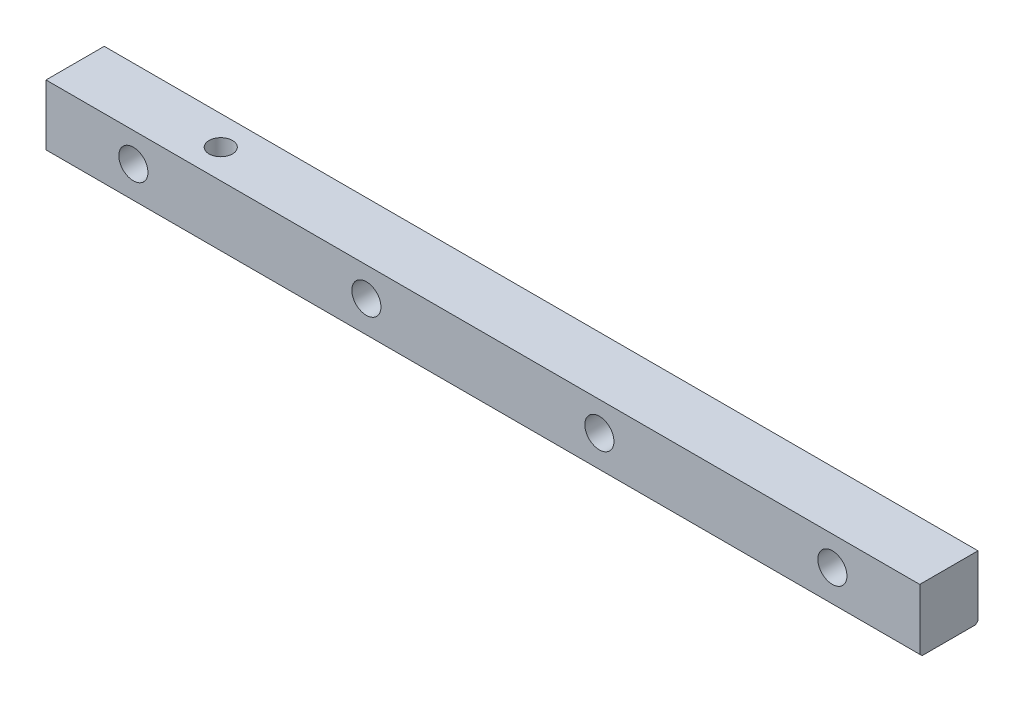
SolidWorks part; units mm, degrees
ref_plane "Front Plane" through (0, 0, 0) normal (0, 0, 1) x (1, 0, 0)
ref_plane "Top Plane" through (0, 0, 0) normal (0, 1, 0) x (1, 0, 0)
ref_plane "Right Plane" through (0, 0, 0) normal (1, 0, 0) x (0, 0, -1)
sketch "Sketch1" plane through (0, 0, 0) normal (0, 0, 1) x (1, 0, 0)
  line L0 (-209.55, 210.01) -> (133.35, 210.01) construction
  line L1 (-209.55, 210.01) -> (-19.05, 210.01)
  line L2 (-209.55, 210.01) -> (-209.55, 196.294)
  line L3 (-209.55, 196.294) -> (-19.05, 196.294)
  line L4 (-19.05, 210.01) -> (-19.05, 196.294)
  line L5 (-209.55, -101.6) -> (-209.55, 210.01) construction
  dimension "D1" = 190.5
  dimension "D2" = 13.716
extrude "Extrude1" add sketch "Sketch1" along normal blind 12.7
sketch "Sketch2" plane through (0, 0, 12.7) normal (0, 0, 1) x (1, 0, 0)
  circle A0 centre (-190.5, 203.66) radius 3.175
  circle A1 centre (-139.7, 203.66) radius 3.175
  circle A2 centre (-88.9, 203.66) radius 3.175
  circle A3 centre (-38.1, 203.66) radius 3.175
  dimension "D1" = 6.35
  dimension "D2" = 6.35
  dimension "D3" = 6.35
  dimension "D4" = 6.35
extrude "mounting holes" cut sketch "Sketch2" against normal through all
chamfer "Chamfer1" distance 0.508 angle 45 2 edges at (-114.3, 196.294, 0) (-114.3, 196.294, 12.7)
sketch "Sketch3" plane through (0, 210.01, 0) normal (0, 1, 0) x (1, 0, 0)
  line L0 (-209.55, -6.35) -> (-157.0038, -6.35) construction
  line L1 (-209.55, -12.7) -> (-209.55, 0) construction
  circle A0 centre (-177.8, -6.35) radius 2.5527
  dimension "D1" = 5.1054
  dimension "D2" = 31.75
extrude "Cut-Extrude1" cut sketch "Sketch3" against normal through all
